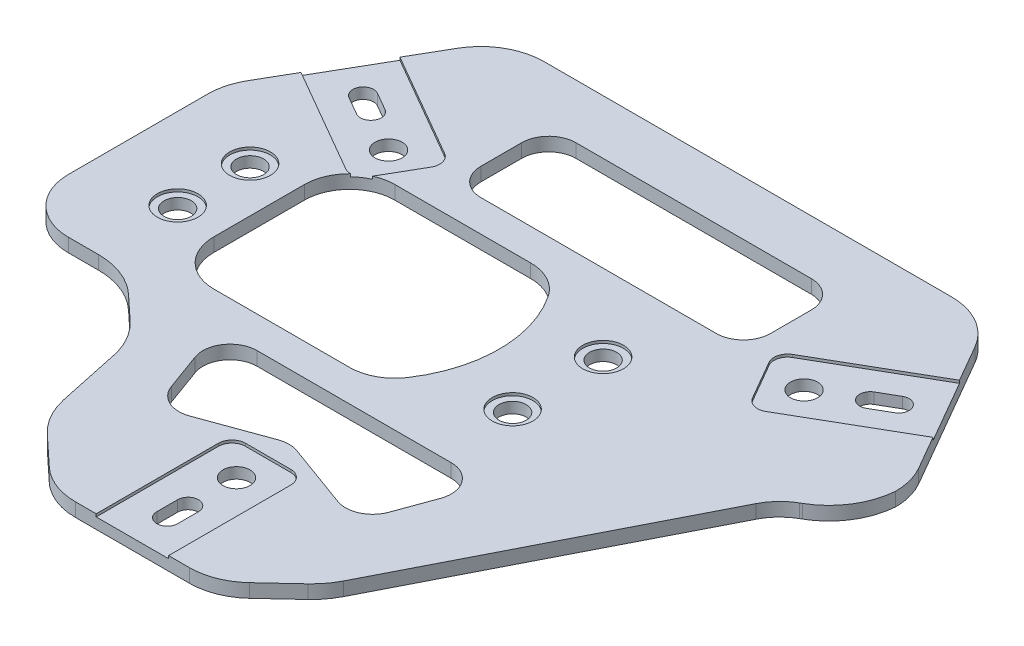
SolidWorks part; units mm, degrees
ref_plane "Front Plane" through (0, 0, 0) normal (0, 0, 1) x (1, 0, 0)
ref_plane "Top Plane" through (0, 0, 0) normal (0, 1, 0) x (1, 0, 0)
ref_plane "Right Plane" through (0, 0, 0) normal (1, 0, 0) x (0, 0, -1)
imported_body "PEN-019375-2020 vFinal.step"
sketch "Sketch1" plane through (0, 1.5, 0) normal (0, 1, 0) x (1, 0, 0)
  line L1 (-242.3525, -216.2983) -> (-238.9945, -216.2983)
  line L2 (-242.3525, -216.2983) -> (-242.3525, -220.3638)
  line L3 (-242.3525, -220.3638) -> (-238.9945, -220.3638)
  line L4 (-238.9945, -216.2983) -> (-238.9945, -220.3638)
  line L5 (-242.3525, -229.0649) -> (-238.9945, -229.0649)
  line L6 (-242.3525, -229.0649) -> (-242.3525, -233.0857)
  line L7 (-242.3525, -233.0857) -> (-238.9945, -233.0857)
  line L8 (-238.9945, -229.0649) -> (-238.9945, -233.0857)
  line L9 (-187.1625, -216.4158) -> (-182.8486, -216.4158)
  line L10 (-187.1625, -216.4158) -> (-187.1625, -220.0414)
  line L11 (-187.1625, -220.0414) -> (-182.8486, -220.0414)
  line L12 (-182.8486, -216.4158) -> (-182.8486, -220.0414)
  line L13 (-187.1625, -230.35) -> (-182.9896, -230.35)
  line L14 (-187.1625, -230.35) -> (-187.1625, -233.959)
  line L15 (-187.1625, -233.959) -> (-182.9896, -233.959)
  line L16 (-182.9896, -230.35) -> (-182.9896, -233.959)
extrude "Boss-Extrude1" add sketch "Sketch1" against normal up to surface (1.5 mm away)
sketch "Sketch2" plane through (0, 1.5, 0) normal (0, 1, 0) x (1, 0, 0)
  line L0 (-210.6744, -262.7812) -> (-210.6744, -249.2812) construction
  line L1 (-209.1744, -247.7812) -> (-204.1744, -247.7812) construction
  line L2 (-202.6744, -249.2812) -> (-202.6744, -262.7812) construction
  line L3 (-202.6744, -262.7812) -> (-210.6744, -262.7812) construction
  line L4 (-175.7655, -202.3171) -> (-171.7655, -209.2453) construction
  line L5 (-171.7655, -209.2453) -> (-183.4568, -215.9953) construction
  line L6 (-185.5059, -215.4463) -> (-188.0059, -211.1162) construction
  line L7 (-187.4568, -209.0671) -> (-175.7655, -202.3171) construction
  line L8 (-225.343, -211.1162) -> (-227.7088, -215.2138) construction
  line L9 (-229.8921, -215.9953) -> (-241.5834, -209.2453) construction
  line L10 (-241.5834, -209.2453) -> (-237.5834, -202.3171) construction
  line L11 (-237.5834, -202.3171) -> (-225.8921, -209.0671) construction
  line L12 (-210.6744, -262.7812) -> (-210.6744, -249.2812)
  line L13 (-209.1744, -247.7812) -> (-204.1744, -247.7812)
  line L14 (-202.6744, -249.2812) -> (-202.6744, -262.7812)
  line L15 (-202.6744, -262.7812) -> (-210.6744, -262.7812)
  line L16 (-175.7655, -202.3171) -> (-171.7655, -209.2453)
  line L17 (-171.7655, -209.2453) -> (-183.4568, -215.9953)
  line L18 (-185.5059, -215.4463) -> (-188.0059, -211.1162)
  line L19 (-187.4568, -209.0671) -> (-175.7655, -202.3171)
  line L20 (-225.343, -211.1162) -> (-227.7088, -215.2138)
  line L21 (-229.8921, -215.9953) -> (-241.5834, -209.2453)
  line L22 (-241.5834, -209.2453) -> (-237.5834, -202.3171)
  line L23 (-237.5834, -202.3171) -> (-225.8921, -209.0671)
  arc A0 (-235.6744, -226.5312) -> (-235.6744, -231.0312) centre (-235.6744, -228.7812) ccw construction
  arc A1 (-235.6744, -231.0312) -> (-235.6744, -226.5312) centre (-235.6744, -228.7812) ccw construction
  arc A2 (-235.6744, -218.5312) -> (-235.6744, -223.0312) centre (-235.6744, -220.7812) ccw construction
  arc A3 (-235.6744, -223.0312) -> (-235.6744, -218.5312) centre (-235.6744, -220.7812) ccw construction
  arc A4 (-197.6744, -232.0312) -> (-197.6744, -227.5312) centre (-197.6744, -229.7812) ccw construction
  arc A5 (-197.6744, -227.5312) -> (-197.6744, -232.0312) centre (-197.6744, -229.7812) ccw construction
  arc A6 (-197.6744, -217.5312) -> (-197.6744, -222.0312) centre (-197.6744, -219.7812) ccw construction
  arc A7 (-197.6744, -222.0312) -> (-197.6744, -217.5312) centre (-197.6744, -219.7812) ccw construction
  arc A8 (-209.1744, -247.7812) -> (-210.6744, -249.2812) centre (-209.1744, -249.2812) ccw construction
  arc A9 (-202.6744, -249.2812) -> (-204.1744, -247.7812) centre (-204.1744, -249.2812) ccw construction
  arc A10 (-185.5059, -215.4463) -> (-183.4568, -215.9953) centre (-184.2068, -214.6963) ccw construction
  arc A11 (-187.4568, -209.0671) -> (-188.0059, -211.1162) centre (-186.7068, -210.3662) ccw construction
  arc A12 (-227.7088, -215.2138) -> (-229.1598, -216.1962) centre (-225.6744, -219.7812) ccw construction
  arc A13 (-229.8921, -215.9953) -> (-229.1598, -216.1962) centre (-229.1421, -214.6963) ccw construction
  arc A14 (-225.343, -211.1162) -> (-225.8921, -209.0671) centre (-226.6421, -210.3662) ccw construction
  arc A15 (-235.6744, -226.5312) -> (-235.6744, -231.0312) centre (-235.6744, -228.7812) ccw
  arc A16 (-235.6744, -231.0312) -> (-235.6744, -226.5312) centre (-235.6744, -228.7812) ccw
  arc A17 (-235.6744, -218.5312) -> (-235.6744, -223.0312) centre (-235.6744, -220.7812) ccw
  arc A18 (-235.6744, -223.0312) -> (-235.6744, -218.5312) centre (-235.6744, -220.7812) ccw
  arc A19 (-197.6744, -232.0312) -> (-197.6744, -227.5312) centre (-197.6744, -229.7812) ccw
  arc A20 (-197.6744, -227.5312) -> (-197.6744, -232.0312) centre (-197.6744, -229.7812) ccw
  arc A21 (-197.6744, -217.5312) -> (-197.6744, -222.0312) centre (-197.6744, -219.7812) ccw
  arc A22 (-197.6744, -222.0312) -> (-197.6744, -217.5312) centre (-197.6744, -219.7812) ccw
  arc A23 (-209.1744, -247.7812) -> (-210.6744, -249.2812) centre (-209.1744, -249.2812) ccw
  arc A24 (-202.6744, -249.2812) -> (-204.1744, -247.7812) centre (-204.1744, -249.2812) ccw
  arc A25 (-185.5059, -215.4463) -> (-183.4568, -215.9953) centre (-184.2068, -214.6963) ccw
  arc A26 (-187.4568, -209.0671) -> (-188.0059, -211.1162) centre (-186.7068, -210.3662) ccw
  arc A27 (-227.7088, -215.2138) -> (-229.1598, -216.1962) centre (-225.6744, -219.7812) ccw
  arc A28 (-229.8921, -215.9953) -> (-229.1598, -216.1962) centre (-229.1421, -214.6963) ccw
  arc A29 (-225.343, -211.1162) -> (-225.8921, -209.0671) centre (-226.6421, -210.3662) ccw
extrude "Cut-Extrude1" cut sketch "Sketch2" against normal blind 0.3
sketch "Sketch3" plane through (0, 0, 0) normal (0, -1, 0) x (1, 0, 0)
  line L0 (-175.7655, 202.3171) -> (-171.7655, 209.2453) construction
  line L1 (-171.7655, 209.2453) -> (-183.4568, 215.9953) construction
  line L2 (-185.5059, 215.4463) -> (-188.0059, 211.1162) construction
  line L3 (-187.4568, 209.0671) -> (-175.7655, 202.3171) construction
  line L4 (-225.343, 211.1162) -> (-227.7088, 215.2138) construction
  line L5 (-229.8921, 215.9953) -> (-241.5834, 209.2453) construction
  line L6 (-241.5834, 209.2453) -> (-237.5834, 202.3171) construction
  line L7 (-237.5834, 202.3171) -> (-225.8921, 209.0671) construction
  line L8 (-210.6744, 262.7812) -> (-210.6744, 249.2812) construction
  line L9 (-209.1744, 247.7812) -> (-204.1744, 247.7812) construction
  line L10 (-202.6744, 249.2812) -> (-202.6744, 262.7812) construction
  line L11 (-202.6744, 262.7812) -> (-210.6744, 262.7812) construction
  line L12 (-175.7655, 202.3171) -> (-171.7655, 209.2453)
  line L13 (-171.7655, 209.2453) -> (-183.4568, 215.9953)
  line L14 (-185.5059, 215.4463) -> (-188.0059, 211.1162)
  line L15 (-187.4568, 209.0671) -> (-175.7655, 202.3171)
  line L16 (-225.343, 211.1162) -> (-227.7088, 215.2138)
  line L17 (-229.8921, 215.9953) -> (-241.5834, 209.2453)
  line L18 (-241.5834, 209.2453) -> (-237.5834, 202.3171)
  line L19 (-237.5834, 202.3171) -> (-225.8921, 209.0671)
  line L20 (-210.6744, 262.7812) -> (-210.6744, 249.2812)
  line L21 (-209.1744, 247.7812) -> (-204.1744, 247.7812)
  line L22 (-202.6744, 249.2812) -> (-202.6744, 262.7812)
  line L23 (-202.6744, 262.7812) -> (-210.6744, 262.7812)
  arc A0 (-183.4568, 215.9953) -> (-185.5059, 215.4463) centre (-184.2068, 214.6963) ccw construction
  arc A1 (-188.0059, 211.1162) -> (-187.4568, 209.0671) centre (-186.7068, 210.3662) ccw construction
  arc A2 (-229.1598, 216.1962) -> (-227.7088, 215.2138) centre (-225.6744, 219.7812) ccw construction
  arc A3 (-229.1598, 216.1962) -> (-229.8921, 215.9953) centre (-229.1421, 214.6963) ccw construction
  arc A4 (-225.8921, 209.0671) -> (-225.343, 211.1162) centre (-226.6421, 210.3662) ccw construction
  arc A5 (-235.6744, 223.0312) -> (-235.6744, 218.5312) centre (-235.6744, 220.7812) ccw construction
  arc A6 (-235.6744, 218.5312) -> (-235.6744, 223.0312) centre (-235.6744, 220.7812) ccw construction
  arc A7 (-197.6744, 222.0312) -> (-197.6744, 217.5312) centre (-197.6744, 219.7812) ccw construction
  arc A8 (-197.6744, 217.5312) -> (-197.6744, 222.0312) centre (-197.6744, 219.7812) ccw construction
  arc A9 (-197.6744, 227.5312) -> (-197.6744, 232.0312) centre (-197.6744, 229.7812) ccw construction
  arc A10 (-197.6744, 232.0312) -> (-197.6744, 227.5312) centre (-197.6744, 229.7812) ccw construction
  arc A11 (-235.6744, 231.0312) -> (-235.6744, 226.5312) centre (-235.6744, 228.7812) ccw construction
  arc A12 (-235.6744, 226.5312) -> (-235.6744, 231.0312) centre (-235.6744, 228.7812) ccw construction
  arc A13 (-210.6744, 249.2812) -> (-209.1744, 247.7812) centre (-209.1744, 249.2812) ccw construction
  arc A14 (-204.1744, 247.7812) -> (-202.6744, 249.2812) centre (-204.1744, 249.2812) ccw construction
  arc A15 (-183.4568, 215.9953) -> (-185.5059, 215.4463) centre (-184.2068, 214.6963) ccw
  arc A16 (-188.0059, 211.1162) -> (-187.4568, 209.0671) centre (-186.7068, 210.3662) ccw
  arc A17 (-229.1598, 216.1962) -> (-227.7088, 215.2138) centre (-225.6744, 219.7812) ccw
  arc A18 (-229.1598, 216.1962) -> (-229.8921, 215.9953) centre (-229.1421, 214.6963) ccw
  arc A19 (-225.8921, 209.0671) -> (-225.343, 211.1162) centre (-226.6421, 210.3662) ccw
  arc A20 (-235.6744, 223.0312) -> (-235.6744, 218.5312) centre (-235.6744, 220.7812) ccw
  arc A21 (-235.6744, 218.5312) -> (-235.6744, 223.0312) centre (-235.6744, 220.7812) ccw
  arc A22 (-197.6744, 222.0312) -> (-197.6744, 217.5312) centre (-197.6744, 219.7812) ccw
  arc A23 (-197.6744, 217.5312) -> (-197.6744, 222.0312) centre (-197.6744, 219.7812) ccw
  arc A24 (-197.6744, 227.5312) -> (-197.6744, 232.0312) centre (-197.6744, 229.7812) ccw
  arc A25 (-197.6744, 232.0312) -> (-197.6744, 227.5312) centre (-197.6744, 229.7812) ccw
  arc A26 (-235.6744, 231.0312) -> (-235.6744, 226.5312) centre (-235.6744, 228.7812) ccw
  arc A27 (-235.6744, 226.5312) -> (-235.6744, 231.0312) centre (-235.6744, 228.7812) ccw
  arc A28 (-210.6744, 249.2812) -> (-209.1744, 247.7812) centre (-209.1744, 249.2812) ccw
  arc A29 (-204.1744, 247.7812) -> (-202.6744, 249.2812) centre (-204.1744, 249.2812) ccw
extrude "Boss-Extrude2" add sketch "Sketch3" against normal up to surface (0.3 mm away)
sketch "Sketch4" plane through (0, 0.3, 0) normal (0, 1, 0) x (1, 0, 0)
  line L0 (-205.5244, -258.9312) -> (-205.5244, -256.6312) construction
  line L1 (-207.8244, -256.6312) -> (-207.8244, -258.9312) construction
  line L2 (-178.5165, -209.8522) -> (-176.5247, -208.7022) construction
  line L3 (-177.6747, -206.7103) -> (-179.6665, -207.8603) construction
  line L4 (-233.6824, -207.8603) -> (-235.6742, -206.7103) construction
  line L5 (-236.8242, -208.7022) -> (-234.8324, -209.8522) construction
  line L6 (-205.5244, -258.9312) -> (-205.5244, -256.6312)
  line L7 (-207.8244, -256.6312) -> (-207.8244, -258.9312)
  line L8 (-178.5165, -209.8522) -> (-176.5247, -208.7022)
  line L9 (-177.6747, -206.7103) -> (-179.6665, -207.8603)
  line L10 (-233.6824, -207.8603) -> (-235.6742, -206.7103)
  line L11 (-236.8242, -208.7022) -> (-234.8324, -209.8522)
  arc A0 (-205.5244, -256.6312) -> (-207.8244, -256.6312) centre (-206.6744, -256.6312) ccw construction
  arc A1 (-207.8244, -258.9312) -> (-206.6744, -260.0812) centre (-206.6744, -258.9312) ccw construction
  arc A2 (-206.6744, -260.0812) -> (-205.5244, -258.9312) centre (-206.6744, -258.9312) ccw construction
  arc A3 (-206.6744, -249.7812) -> (-206.6744, -252.7812) centre (-206.6744, -251.2812) ccw construction
  arc A4 (-206.6744, -252.7812) -> (-206.6744, -249.7812) centre (-206.6744, -251.2812) ccw construction
  arc A5 (-176.5247, -208.7022) -> (-177.6747, -206.7103) centre (-177.0997, -207.7062) ccw construction
  arc A6 (-179.6665, -207.8603) -> (-179.0915, -210.0062) centre (-179.0915, -208.8562) ccw construction
  arc A7 (-179.0915, -210.0062) -> (-178.5165, -209.8522) centre (-179.0915, -208.8562) ccw construction
  arc A8 (-183.7248, -210.0312) -> (-183.7248, -213.0312) centre (-183.7248, -211.5312) ccw construction
  arc A9 (-183.7248, -213.0312) -> (-183.7248, -210.0312) centre (-183.7248, -211.5312) ccw construction
  arc A10 (-197.6744, -228.2812) -> (-197.6744, -231.2812) centre (-197.6744, -229.7812) ccw construction
  arc A11 (-197.6744, -231.2812) -> (-197.6744, -228.2812) centre (-197.6744, -229.7812) ccw construction
  arc A12 (-197.6744, -218.2812) -> (-197.6744, -221.2812) centre (-197.6744, -219.7812) ccw construction
  arc A13 (-197.6744, -221.2812) -> (-197.6744, -218.2812) centre (-197.6744, -219.7812) ccw construction
  arc A14 (-235.6744, -227.2812) -> (-235.6744, -230.2812) centre (-235.6744, -228.7812) ccw construction
  arc A15 (-235.6744, -230.2812) -> (-235.6744, -227.2812) centre (-235.6744, -228.7812) ccw construction
  arc A16 (-235.6744, -219.2812) -> (-235.6744, -222.2812) centre (-235.6744, -220.7812) ccw construction
  arc A17 (-235.6744, -222.2812) -> (-235.6744, -219.2812) centre (-235.6744, -220.7812) ccw construction
  arc A18 (-229.6241, -210.0312) -> (-229.6241, -213.0312) centre (-229.6241, -211.5312) ccw construction
  arc A19 (-229.6241, -213.0312) -> (-229.6241, -210.0312) centre (-229.6241, -211.5312) ccw construction
  arc A20 (-235.6742, -206.7103) -> (-236.8242, -208.7022) centre (-236.2492, -207.7062) ccw construction
  arc A21 (-234.8324, -209.8522) -> (-234.2574, -210.0062) centre (-234.2574, -208.8562) ccw construction
  arc A22 (-234.2574, -210.0062) -> (-233.6824, -207.8603) centre (-234.2574, -208.8562) ccw construction
  arc A23 (-205.5244, -256.6312) -> (-207.8244, -256.6312) centre (-206.6744, -256.6312) ccw
  arc A24 (-207.8244, -258.9312) -> (-206.6744, -260.0812) centre (-206.6744, -258.9312) ccw
  arc A25 (-206.6744, -260.0812) -> (-205.5244, -258.9312) centre (-206.6744, -258.9312) ccw
  arc A26 (-206.6744, -249.7812) -> (-206.6744, -252.7812) centre (-206.6744, -251.2812) ccw
  arc A27 (-206.6744, -252.7812) -> (-206.6744, -249.7812) centre (-206.6744, -251.2812) ccw
  arc A28 (-176.5247, -208.7022) -> (-177.6747, -206.7103) centre (-177.0997, -207.7062) ccw
  arc A29 (-179.6665, -207.8603) -> (-179.0915, -210.0062) centre (-179.0915, -208.8562) ccw
  arc A30 (-179.0915, -210.0062) -> (-178.5165, -209.8522) centre (-179.0915, -208.8562) ccw
  arc A31 (-183.7248, -210.0312) -> (-183.7248, -213.0312) centre (-183.7248, -211.5312) ccw
  arc A32 (-183.7248, -213.0312) -> (-183.7248, -210.0312) centre (-183.7248, -211.5312) ccw
  arc A33 (-197.6744, -228.2812) -> (-197.6744, -231.2812) centre (-197.6744, -229.7812) ccw
  arc A34 (-197.6744, -231.2812) -> (-197.6744, -228.2812) centre (-197.6744, -229.7812) ccw
  arc A35 (-197.6744, -218.2812) -> (-197.6744, -221.2812) centre (-197.6744, -219.7812) ccw
  arc A36 (-197.6744, -221.2812) -> (-197.6744, -218.2812) centre (-197.6744, -219.7812) ccw
  arc A37 (-235.6744, -227.2812) -> (-235.6744, -230.2812) centre (-235.6744, -228.7812) ccw
  arc A38 (-235.6744, -230.2812) -> (-235.6744, -227.2812) centre (-235.6744, -228.7812) ccw
  arc A39 (-235.6744, -219.2812) -> (-235.6744, -222.2812) centre (-235.6744, -220.7812) ccw
  arc A40 (-235.6744, -222.2812) -> (-235.6744, -219.2812) centre (-235.6744, -220.7812) ccw
  arc A41 (-229.6241, -210.0312) -> (-229.6241, -213.0312) centre (-229.6241, -211.5312) ccw
  arc A42 (-229.6241, -213.0312) -> (-229.6241, -210.0312) centre (-229.6241, -211.5312) ccw
  arc A43 (-235.6742, -206.7103) -> (-236.8242, -208.7022) centre (-236.2492, -207.7062) ccw
  arc A44 (-234.8324, -209.8522) -> (-234.2574, -210.0062) centre (-234.2574, -208.8562) ccw
  arc A45 (-234.2574, -210.0062) -> (-233.6824, -207.8603) centre (-234.2574, -208.8562) ccw
extrude "Cut-Extrude2" cut sketch "Sketch4" against normal through all
sketch "Sketch5" plane through (0, 0, 0) normal (0, -1, 0) x (1, 0, 0)
  line L0 (-204.1578, 224.7812) -> (-204.1578, 231.5474) construction
  line L1 (-206.5171, 232.559) -> (-207.6767, 232.559)
  line L2 (-207.6767, 232.559) -> (-207.55, 217.0035)
  line L3 (-207.55, 217.0035) -> (-206.5171, 217.0035)
  arc A0 (-206.5171, 232.559) -> (-206.5171, 217.0035) centre (-218.1578, 224.7812) cw
  arc A1 (-205.6744, 229.7812) -> (-210.6744, 234.7812) centre (-210.6744, 229.7812) ccw construction
  arc A2 (-210.6744, 214.7812) -> (-205.6744, 219.7812) centre (-210.6744, 219.7812) ccw construction
  dimension "D1" = 14
extrude "Cut-Extrude4" cut sketch "Sketch5" against normal through all
ref_plane "Plane1" through (0, 0.75, 0) normal (0, -1, 0) x (-1, 0, 0)
sketch "Sketch6" plane through (0, 0.75, 0) normal (0, -1, 0) x (-1, 0, 0)
  line L0 (206.6744, -224.7812) -> (206.6744, -251.2812)
  line L1 (206.6744, -224.7812) -> (233.1744, -224.7812)
  circle A0 centre (206.6744, -224.7812) radius 26.5
  point P0 (206.6744, -251.2812)
  point P1 (183.7248, -211.5312)
  point P3 (229.6241, -211.5312)
